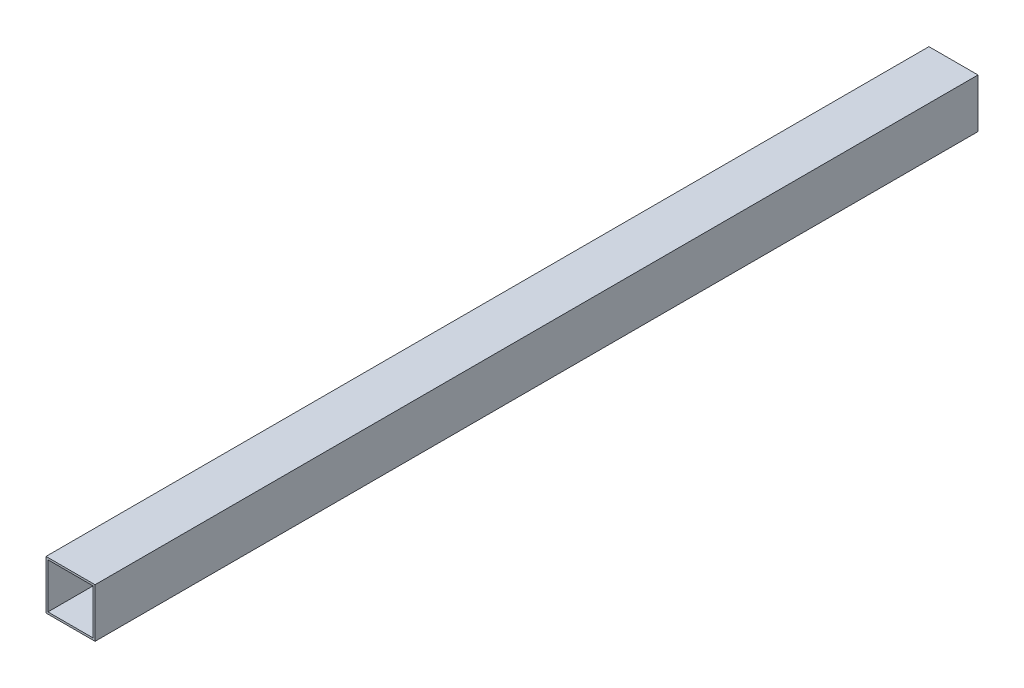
SolidWorks part; units mm, degrees
ref_plane "Piano frontale" through (0, 0, 0) normal (0, 0, 1) x (1, 0, 0)
ref_plane "Piano superiore" through (0, 0, 0) normal (0, 1, 0) x (1, 0, 0)
ref_plane "Piano destro" through (0, 0, 0) normal (1, 0, 0) x (0, 0, -1)
sketch "Schizzo1" plane through (0, 0, 0) normal (0, 0, 1) x (1, 0, 0)
  line L1 (-25, -25) -> (25, -25)
  line L2 (-25, -25) -> (-25, 25)
  line L3 (-25, 25) -> (25, 25)
  line L4 (25, -25) -> (25, 25)
  line L5 (-25, -25) -> (25, 25) construction
  line L6 (-25, 25) -> (25, -25) construction
  point P0 (0, 0)
  dimension "D1" = 50
  dimension "D2" = 50
extrude "Estrusione-Sottile1" add sketch "Schizzo1" along normal blind 900 thin
